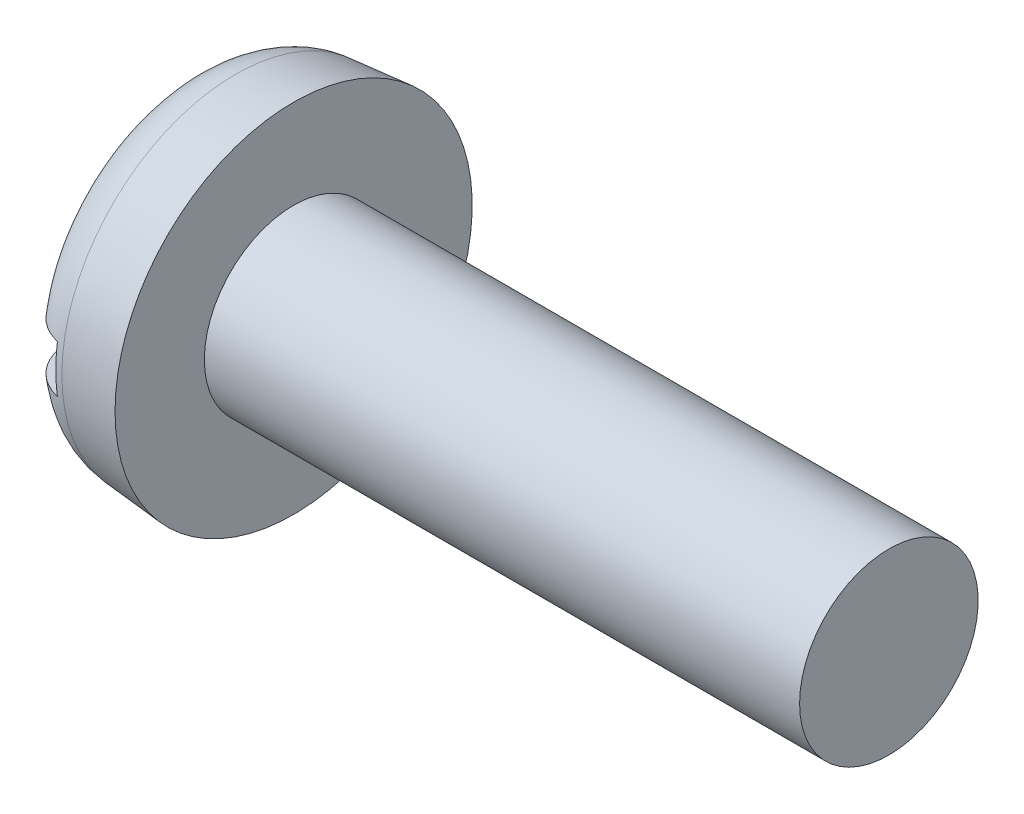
SolidWorks part; units mm, degrees
ref_plane "Plane1" through (0, 0, 0) normal (0, 0, 1) x (1, 0, 0)
ref_plane "Plane2" through (0, 0, 0) normal (0, 1, 0) x (1, 0, 0)
ref_plane "Plane3" through (0, 0, 0) normal (1, 0, 0) x (0, 0, -1)
sketch "BodySke" plane through (0, 0, 0) normal (0, 0, 1) x (1, 0, 0)
  line L0 (3.6, 3) -> (3.6, 6)
  line L1 (0, 0) -> (0, 5.685)
  line L2 (-25.4, 0) -> (127, 0) construction
  line L3 (23.6, 0) -> (0, 0)
  line L4 (3.6, 3) -> (23.6, 3)
  line L5 (23.6, 3) -> (23.6, 0)
  line L6 (0, 5.685) -> (3.6, 6)
  line L9 (4.6, 4.5875) -> (4.6, -4.9375) construction
  line L10 (3.6, 6.35) -> (3.6, -3.175) construction
  dimension "Head_ht" = 3.6
  dimension "Diameter" = 6
  dimension "Length" = 20
  dimension "Head_dia" = 12
  dimension "Advance" = 1
  dimension "Thread_nom" = 20
  dimension "Head_side_angle" = 5
revolve "Base-Revolve" add sketch "BodySke"
fillet "Fillet1" [suppressed] radius 0.25
fillet "Fillet2" radius 1.8 1 edges at (0, 0, 5.685)
sketch "Sketch2" plane through (0, 0, 0) normal (1, 0, 0) x (0, 0, -1)
  line L0 (6, -0.8) -> (-6, -0.8)
  line L1 (6, -0.8) -> (6, 0.8)
  line L2 (-6, 0.8) -> (6, 0.8)
  line L3 (-6, 0.8) -> (-6, -0.8)
  dimension "D1" = 12
  dimension "D2" = 6
  dimension "Slot_width" = 1.6
  dimension "D3" = 0.8
extrude "Slot" cut sketch "Sketch2" along normal blind 1.4
sketch "ThdSchSke" plane through (0, 0, 0) normal (0, 0, 1) x (1, 0, 0)
  line L0 (5.6, -2.4455) -> (5.2117, -3)
  line L1 (5.6, -2.4455) -> (5.9883, -3)
  line L2 (5.9883, -3) -> (5.9883, -3.75)
  line L3 (-3.175, 0) -> (5.1513, 0) construction
  line L5 (5.9883, -3.75) -> (5.2117, -3.75)
  line L6 (5.2117, -3.75) -> (5.2117, -3)
  dimension "Thread_minor" = 4.891
  dimension "Diameter" = 6
  dimension "Start" = 5.6
  dimension "SideAngle" = 55
  dimension "VeeAngle" = 70
  dimension "Overcut" = 7.5
revolve "ThreadSchematic" [suppressed] cut sketch "ThdSchSke" angle 360 about L3
pattern_linear "ThdSchPat" [suppressed]
equation "\"D1@Sketch2\" = \"Head_dia@BodySke\""
equation "\"D2@Sketch2\" = \"D1@Sketch2\" / 2"
equation "\"D3@Sketch2\" = \"Slot_width@Sketch2\" / 2"
equation "\"Thread_length@ThreadCosmetic\" = ((sgn( (\"Length@BodySke\" - \"Advance@BodySke\" * 2.0 ) - \"Thread_nom@BodySke\" )-1)*( (\"Length@BodySke\" - \"Advance@BodySke\"  * 2.0) - \"Thread_nom@BodySke\" ))/-2+ \"Thread_"
equation "\"Thread_minor@ThdSchSke\" = \"Thread_minor@ThreadCosmetic\""
equation "\"Diameter@ThdSchSke\" = \"Diameter@BodySke\""
equation "\"Overcut@ThdSchSke\" = \"Diameter@BodySke\" * 1.25"
equation "\"Start@ThdSchSke\" = \"Head_ht@BodySke\" + \"Length@BodySke\" - \"Thread_length@ThreadCosmetic\"  '---Non-countersunk---"
equation "\"Num_threads@ThdSchPat\" = int( \"Thread_length@ThreadCosmetic\" / \"Advance@BodySke\" + 0.999 )  + 1"
equation "\"Advance@ThdSchPat\" = \"Thread_length@ThreadCosmetic\" /  (\"Num_threads@ThdSchPat\" - 1) 'relax it"
